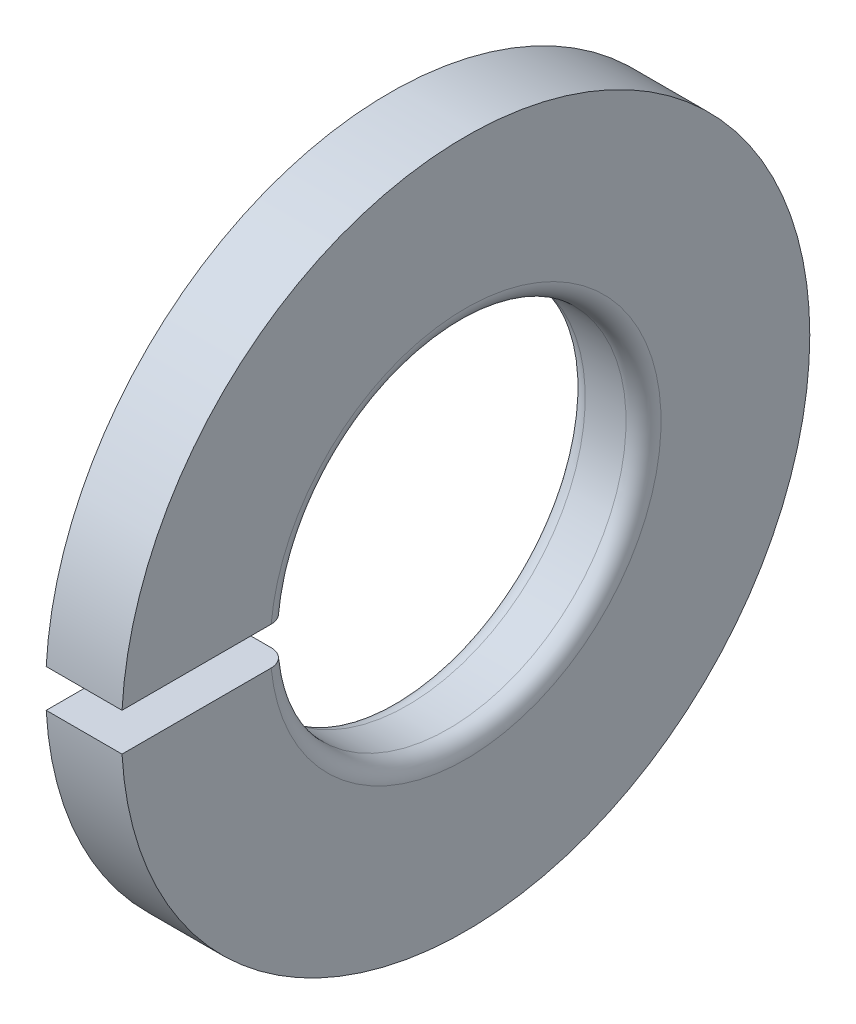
SolidWorks part; units mm, degrees
ref_plane "Plane1" through (0, 0, 0) normal (0, 0, 1) x (1, 0, 0)
ref_plane "Plane2" through (0, 0, 0) normal (0, 1, 0) x (1, 0, 0)
ref_plane "Plane3" through (0, 0, 0) normal (1, 0, 0) x (0, 0, -1)
sketch "Sketch1" plane through (0, 0, 0) normal (0, 0, 1) x (1, 0, 0)
  line L0 (-34.925, 0) -> (9.525, 0) construction
  line L1 (0, 3.35) -> (0, 5.9)
  line L2 (0, 5.9) -> (-1.3, 5.9)
  line L3 (-1.3, 5.9) -> (-1.3, 3.35)
  line L4 (-1, 3.05) -> (-0.3, 3.05)
  arc A0 (-1, 3.05) -> (-1.3, 3.35) centre (-1, 3.35) cw
  arc A1 (0, 3.35) -> (-0.3, 3.05) centre (-0.3, 3.35) cw
  point P8 (-1.3, 3.05)
  dimension "Fillet_rad" = 0.3
  dimension "D1" = 0.3
  dimension "Thickness" = 1.3
  dimension "Inside_dia" = 6.1
  dimension "Outside_dia" = 11.8
revolve "Base-Revolve" add sketch "Sketch1" angle 360 about L0
sketch "Sketch2" plane through (0, 0, 0) normal (-1, 0, 0) x (0, -1, 0)
  line L0 (-0.325, 0) -> (0.325, 0)
  line L1 (0, 0) -> (0, 12.7) construction
  line L2 (0.325, 0) -> (0.325, 6.018)
  line L3 (0.325, 6.018) -> (-0.325, 6.018)
  line L4 (-0.325, 6.018) -> (-0.325, 0)
  dimension "D1" = 0.65
  dimension "D2" = 6.018
extrude "Gap" cut sketch "Sketch2" along normal through all
equation "\"D1@Sketch1\" = \"Fillet_rad@Sketch1\""
equation "\"D1@Sketch2\" = \"Thickness@Sketch1\" * 0.5"
equation "\"D2@Sketch2\" = \"Outside_dia@Sketch1\" * 0.51"
